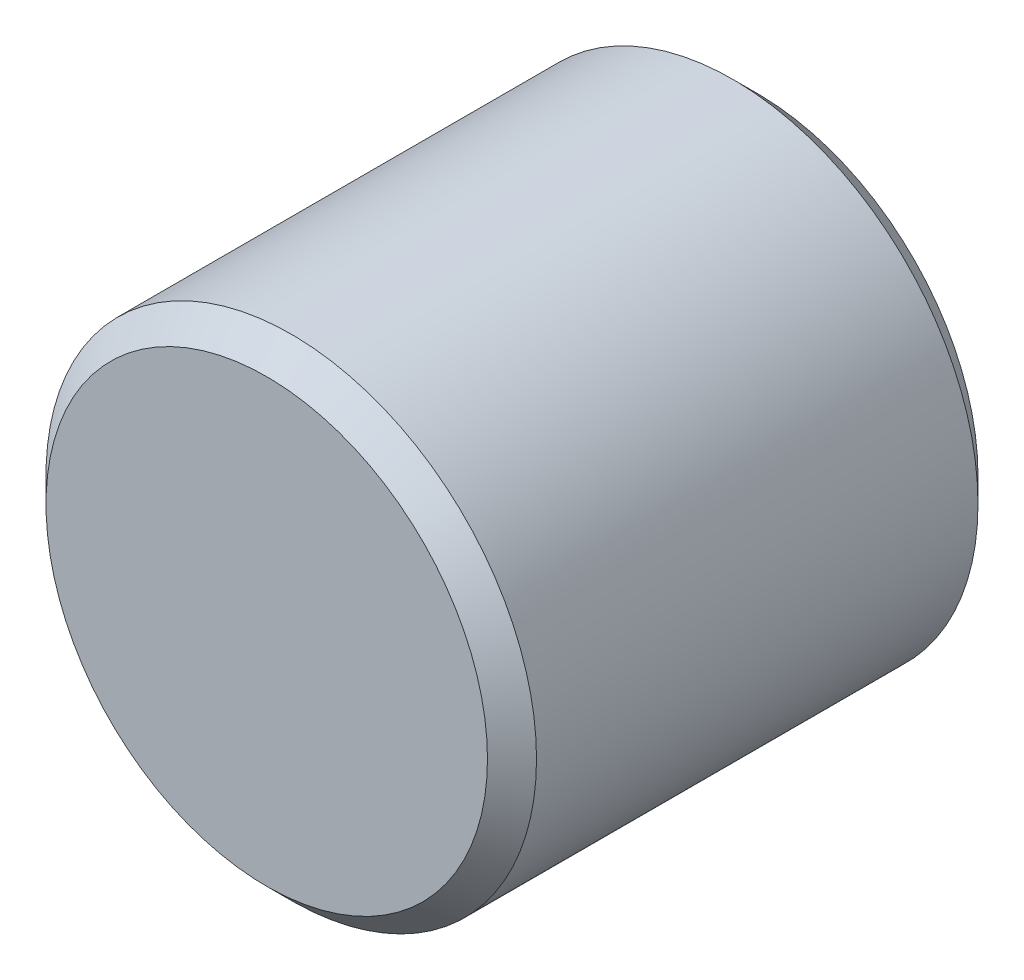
SolidWorks part; units mm, degrees
ref_plane "Front Plane" through (0, 0, 0) normal (0, 0, 1) x (1, 0, 0)
ref_plane "Top Plane" through (0, 0, 0) normal (0, 1, 0) x (1, 0, 0)
ref_plane "Right Plane" through (0, 0, 0) normal (1, 0, 0) x (0, 0, -1)
sketch "Sketch1" plane through (0, 0, 0) normal (0, 0, 1) x (1, 0, 0)
  circle A0 centre (0, 0) radius 25.4
  dimension "D1" = 50.8
extrude "Extrude1" add sketch "Sketch1" along normal blind 50.8
chamfer "Chamfer1" distance 2.54 angle 45 2 edges at (25.4, 0, 0) (25.4, 0, 50.8)
